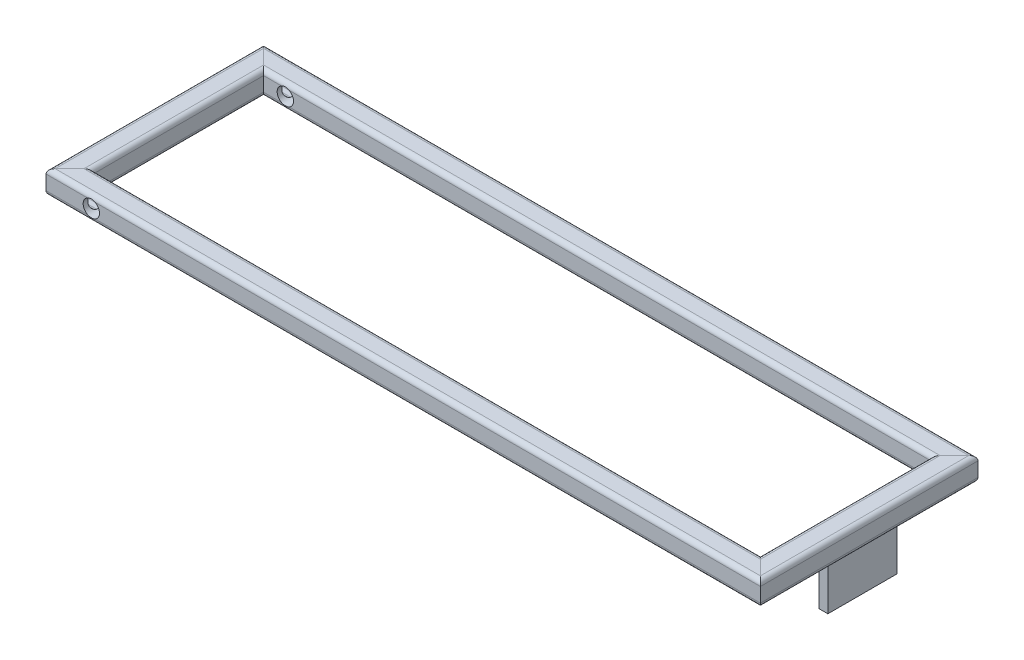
SolidWorks part; units mm, degrees
ref_plane "Front Plane" through (0, 0, 0) normal (0, 0, 1) x (1, 0, 0)
ref_plane "Top Plane" through (0, 0, 0) normal (0, 1, 0) x (1, 0, 0)
ref_plane "Right Plane" through (0, 0, 0) normal (1, 0, 0) x (0, 0, -1)
sketch "Sketch1" plane through (0, 0, 0) normal (0, 1, 0) x (1, 0, 0)
  line L0 (-101.5946, 0) -> (0, 0) construction
  line L1 (-190.5, 53.5) -> (190.5, 53.5)
  line L2 (-190.5, 53.5) -> (-190.5, -53.5)
  line L3 (-190.5, -53.5) -> (190.5, -53.5)
  line L4 (190.5, 53.5) -> (190.5, -53.5)
  line L5 (0, 0) -> (0, 82.5344) construction
  dimension "D1" = 381
  dimension "D2" = 107
other "Structural Member1"
ref_plane "Plane1" through (-190.5, 0, 53.5) normal (1, 0, 0) x (0, 0, -1)
sketch "Sketch11" plane through (-190.5, 0, 53.5) normal (1, 0, 0) x (0, 0, -1)
  line L0 (-10.5789, 0) -> (0, 0) construction
  line L1 (-3.96, 6.5) -> (3.96, 6.5)
  line L2 (-6.5, 3.96) -> (-6.5, -3.96)
  line L3 (-3.96, -6.5) -> (3.96, -6.5)
  line L4 (6.5, 3.96) -> (6.5, -3.96)
  line L5 (0, 0) -> (0, 9.6512) construction
  line L6 (-1.42, 3.96) -> (1.42, 3.96)
  line L7 (3.96, 1.42) -> (3.96, -1.42)
  line L8 (-1.42, -3.96) -> (1.42, -3.96)
  line L9 (-3.96, 1.42) -> (-3.96, -1.42)
  line L10 (-3.96, 3.96) -> (3.96, 3.96) construction
  line L11 (-3.96, 3.96) -> (-3.96, -3.96) construction
  line L12 (3.96, 3.96) -> (3.96, -3.96) construction
  line L13 (-3.96, -3.96) -> (3.96, -3.96) construction
  line L14 (-6.5, 6.5) -> (-6.5, -6.5) construction
  line L15 (-6.5, -6.5) -> (6.5, -6.5) construction
  line L16 (6.5, 6.5) -> (6.5, -6.5) construction
  line L17 (-6.5, 6.5) -> (6.5, 6.5) construction
  arc A0 (-1.42, 3.96) -> (-3.96, 1.42) centre (-1.42, 1.42) ccw
  arc A1 (1.42, 3.96) -> (3.96, 1.42) centre (1.42, 1.42) cw
  arc A2 (3.96, -1.42) -> (1.42, -3.96) centre (1.42, -1.42) cw
  arc A3 (-1.42, -3.96) -> (-3.96, -1.42) centre (-1.42, -1.42) cw
  arc A4 (-6.5, -3.96) -> (-3.96, -6.5) centre (-3.96, -3.96) ccw
  arc A5 (3.96, -6.5) -> (6.5, -3.96) centre (3.96, -3.96) ccw
  arc A6 (3.96, 6.5) -> (6.5, 3.96) centre (3.96, 3.96) cw
  arc A7 (-3.96, 6.5) -> (-6.5, 3.96) centre (-3.96, 3.96) ccw
  point P27 (-6.5, -6.5)
  point P37 (0, 0)
  dimension "D4" = 2.54
  dimension "D1" = 13
  dimension "D2" = 13
  dimension "D3" = 2.54
sketch "Sketch12" plane through (0, 0, 60) normal (0, 0, 1) x (1, 0, 0)
  line L0 (-197, 3.96) -> (-197, -3.96) construction
  circle A0 centre (-172, 0) radius 4.5
  dimension "D1" = 9
  dimension "D2" = 25
extrude "Cut-Extrude1" cut sketch "Sketch12" against normal through all
sketch "Sketch13" plane through (0, -6.5, 0) normal (0, -1, 0) x (1, 0, 0)
  line L1 (188.2, 19) -> (193.2, 19)
  line L2 (188.2, 19) -> (188.2, -19)
  line L3 (188.2, -19) -> (193.2, -19)
  line L4 (193.2, 19) -> (193.2, -19)
  line L5 (0, 0) -> (268.7063, 0) construction
  line L6 (197, -60) -> (197, 60) construction
  dimension "D1" = 5
  dimension "D2" = 38
  dimension "D3" = 3.8
extrude "Boss-Extrude1" add sketch "Sketch13" along normal blind 25 separate body
